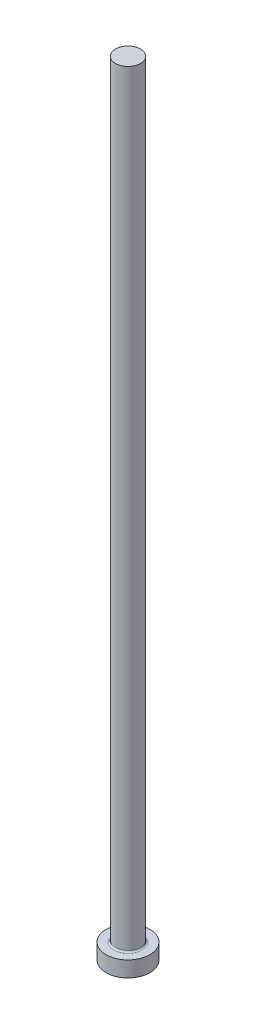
SolidWorks part; units mm, degrees
ref_plane "Plano frontal" through (0, 0, 0) normal (0, 0, 1) x (1, 0, 0)
ref_plane "Plano superior" through (0, 0, 0) normal (0, 1, 0) x (1, 0, 0)
ref_plane "Plano direito" through (0, 0, 0) normal (1, 0, 0) x (0, 0, -1)
sketch "Esboço1" plane through (0, 0, 0) normal (0, 0, 1) x (1, 0, 0)
  line L0 (0, 0) -> (7, 0)
  line L1 (7, 0) -> (7, 5)
  line L2 (7, 5) -> (4.5, 5)
  line L3 (4, 5.5) -> (4, 250)
  line L4 (4, 250) -> (0, 250)
  line L5 (0, 250) -> (0, 0) construction
  line L6 (0, 0) -> (0, 250)
  arc A0 (4.5, 5) -> (4, 5.5) centre (4.5, 5.5) cw
  dimension "D3" = 0.5
  dimension "D1" = 14
  dimension "D2" = 8
  dimension "D4" = 5
  dimension "D5" = 250
revolve "Revolução1" add sketch "Esboço1" angle 360 about L5
sketch "Esboço2"
  dimension "D1" = 0.525
  dimension "D2" = 1.225
  dimension "D3" = 0.7875
  dimension "D4" = 3.7625
wrap "Envolver1" sketch "Esboço2" wrap type deboss source sketch "Esboço2" thickness 0.1 parameters "D1"=0.1
